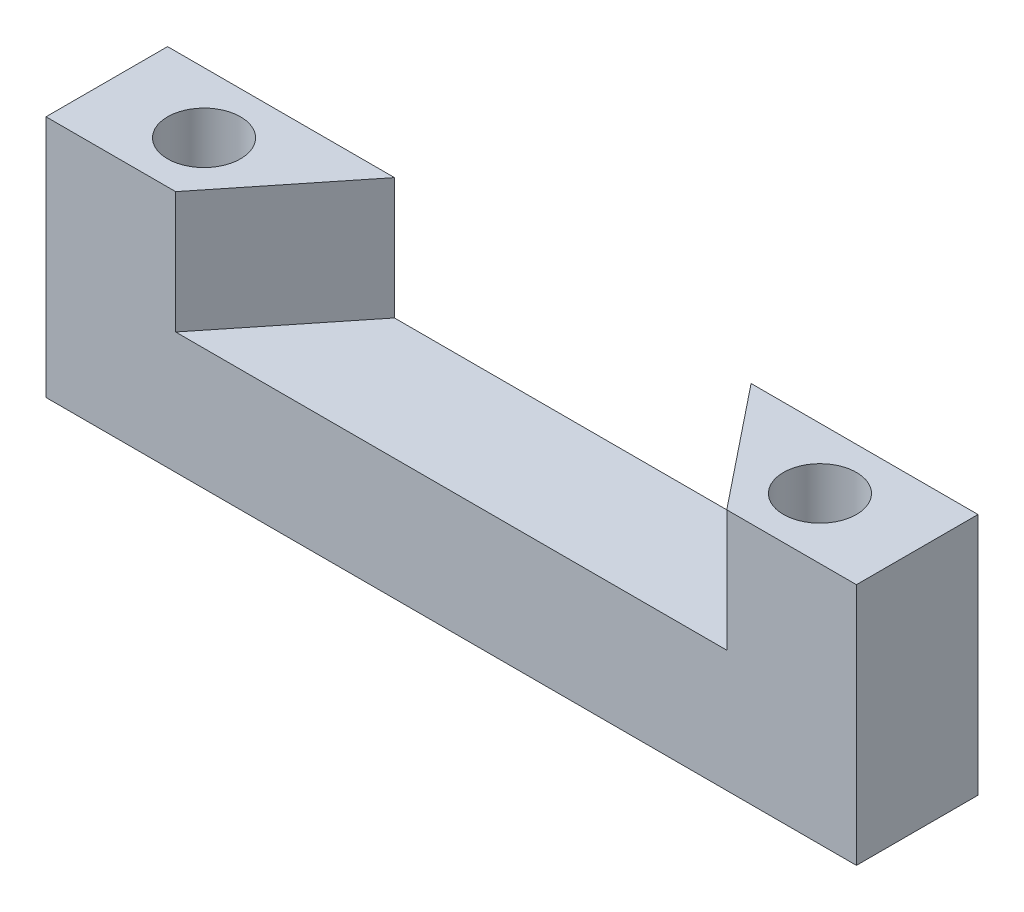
SolidWorks part; units mm, degrees
ref_plane "Face" through (0, 0, 0) normal (0, 0, 1) x (1, 0, 0)
ref_plane "Dessus" through (0, 0, 0) normal (0, 1, 0) x (1, 0, 0)
ref_plane "Droite" through (0, 0, 0) normal (1, 0, 0) x (0, 0, -1)
sketch "Esquisse1" plane through (0, 0, 0) normal (0, 0, 1) x (1, 0, 0)
  line L1 (-50, -15) -> (50, -15)
  line L2 (-50, -15) -> (-50, 15)
  line L3 (-50, 15) -> (50, 15)
  line L4 (50, -15) -> (50, 15)
  dimension "D1" = 100
  dimension "D2" = 50
  dimension "D3" = 30
  dimension "D4" = 15
extrude "Boss.-Extru.1" add sketch "Esquisse1" along normal blind 15
sketch "Esquisse2" plane through (0, 0, 15) normal (0, 0, 1) x (1, 0, 0)
  line L0 (-29.0515, 25) -> (0, 0) construction
  line L1 (0, 0) -> (20.9441, 24.3383) construction
  line L2 (20.9441, 24.3383) -> (-29.0515, 25) construction
  line L3 (50, -15) -> (50, 15) construction
  line L4 (-50.8, -15) -> (76.2, -15) construction
  line L5 (-50, -15) -> (50, -15) construction
  line L6 (-22, 15) -> (-22, 0)
  line L7 (50, 15) -> (-50, 15) construction
  line L8 (-22, 0) -> (22, 0)
  line L9 (22, 0) -> (22, 15)
  line L10 (0, -15) -> (0, 15) construction
  dimension "D1" = 90
  dimension "D2" = 50
  dimension "D3" = 25
  dimension "D4" = 50
  dimension "D5" = 44
  dimension "D6" = 15
extrude "Enlèv. mat.-Extru.1" cut sketch "Esquisse2" against normal up to next
fillet "Congé1" [suppressed] radius 5
other "Perçage1"
sketch "Esquisse3" plane through (0, 15, 0) normal (0, 1, 0) x (-1, 0, 0)
  line L0 (22, 15) -> (50, 15) construction
  line L1 (50, 15) -> (50, 0) construction
  circle A0 centre (38, 7.5) radius 4.5
  dimension "D1" = 9
  dimension "D2" = 7.5
  dimension "D3" = 12
mirror "Symétrie1" about plane through (0, 0, 0) normal (1, 0, 0) of "Perçage1"
chamfer "Chanfrein1" distance 12 distance2 15 2 edges at (22, 7.5, 15) (-22, 7.5, 15)
